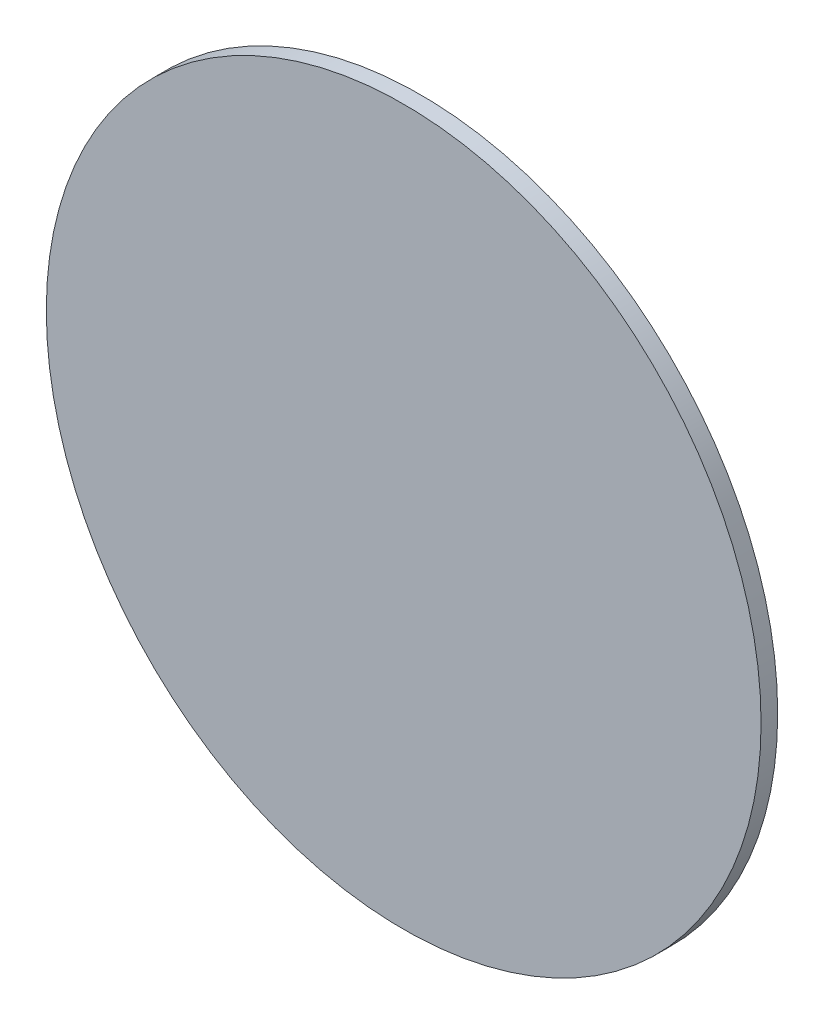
SolidWorks part; units mm, degrees
ref_plane "Face" through (0, 0, 0) normal (0, 0, 1) x (1, 0, 0)
ref_plane "Dessus" through (0, 0, 0) normal (0, 1, 0) x (1, 0, 0)
ref_plane "Droite" through (0, 0, 0) normal (1, 0, 0) x (0, 0, -1)
sketch "Esquisse1" plane through (0, 0, 0) normal (0, 0, 1) x (1, 0, 0)
  circle A0 centre (0, 0) radius 107.5
  dimension "D1" = 215
extrude "Base-Extrusion" add sketch "Esquisse1" along normal blind 5
